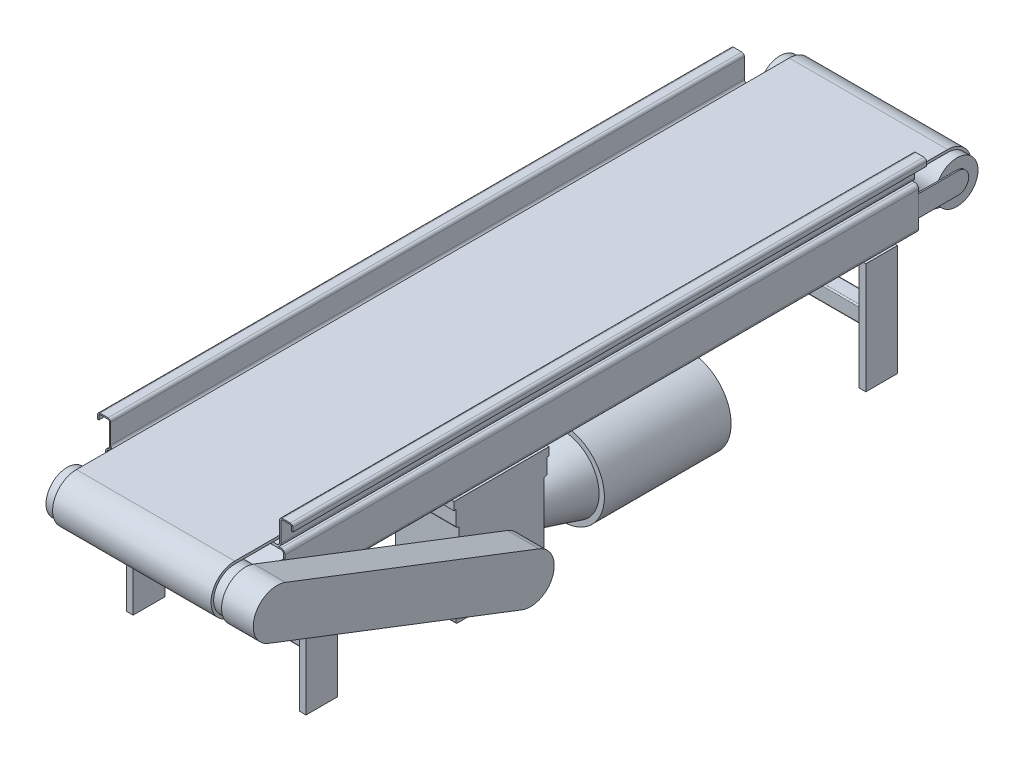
SolidWorks part; units mm, degrees
ref_plane "Front" through (0, 0, 0) normal (0, 0, 1) x (1, 0, 0)
ref_plane "Top" through (0, 0, 0) normal (0, 1, 0) x (1, 0, 0)
ref_plane "Right" through (0, 0, 0) normal (1, 0, 0) x (0, 0, -1)
sketch "Sketch1" plane through (0, 0, 0) normal (0, 0, 1) x (1, 0, 0)
  line L0 (0, 0) -> (0, 127) construction
  line L1 (196.85, 0) -> (-196.85, 0)
  line L2 (-203.2, 6.35) -> (-203.2, 53.975)
  line L3 (-209.55, 60.325) -> (-228.6, 60.325)
  line L4 (-234.95, 53.975) -> (-234.95, 44.45)
  line L5 (234.95, 53.975) -> (234.95, 44.45)
  line L6 (209.55, 60.325) -> (228.6, 60.325)
  line L7 (203.2, 6.35) -> (203.2, 53.975)
  line L8 (-231.775, 53.975) -> (-231.775, 44.45)
  line L9 (-209.55, 57.15) -> (-228.6, 57.15)
  line L10 (-206.375, 6.35) -> (-206.375, 53.975)
  line L11 (196.85, -3.175) -> (-196.85, -3.175)
  line L12 (206.375, 6.35) -> (206.375, 53.975)
  line L13 (209.55, 57.15) -> (228.6, 57.15)
  line L14 (231.775, 53.975) -> (231.775, 44.45)
  line L15 (-234.95, 44.45) -> (-231.775, 44.45)
  line L16 (234.95, 44.45) -> (231.775, 44.45)
  arc A0 (-196.85, 0) -> (-203.2, 6.35) centre (-196.85, 6.35) cw
  arc A1 (-203.2, 53.975) -> (-209.55, 60.325) centre (-209.55, 53.975) ccw
  arc A2 (-228.6, 60.325) -> (-234.95, 53.975) centre (-228.6, 53.975) ccw
  arc A3 (228.6, 60.325) -> (234.95, 53.975) centre (228.6, 53.975) cw
  arc A4 (203.2, 53.975) -> (209.55, 60.325) centre (209.55, 53.975) cw
  arc A5 (196.85, 0) -> (203.2, 6.35) centre (196.85, 6.35) ccw
  arc A6 (-228.6, 57.15) -> (-231.775, 53.975) centre (-228.6, 53.975) ccw
  arc A7 (-206.375, 53.975) -> (-209.55, 57.15) centre (-209.55, 53.975) ccw
  arc A8 (-196.85, -3.175) -> (-206.375, 6.35) centre (-196.85, 6.35) cw
  arc A9 (196.85, -3.175) -> (206.375, 6.35) centre (196.85, 6.35) ccw
  arc A10 (206.375, 53.975) -> (209.55, 57.15) centre (209.55, 53.975) cw
  arc A11 (228.6, 57.15) -> (231.775, 53.975) centre (228.6, 53.975) cw
  dimension "D4" = 6.35
  dimension "D1" = 406.4
  dimension "D2" = 60.325
  dimension "D3" = 31.75
  dimension "D5" = 44.45
  dimension "D6" = 3.175
extrude "Extrude1" add sketch "Sketch1" along normal mid plane 1524
sketch "Sketch2" plane through (0, 0, 0) normal (0, 0, 1) x (1, 0, 0)
  line L0 (-196.85, -3.175) -> (196.85, -3.175) construction
  line L1 (-206.375, -3.175) -> (-184.15, -3.175)
  line L2 (-215.9, -12.7) -> (-215.9, -95.25)
  line L3 (-206.375, -104.775) -> (-184.15, -104.775)
  line L4 (-184.15, -101.6) -> (-184.15, -104.775)
  line L5 (-212.725, -12.7) -> (-212.725, -95.25)
  line L6 (-206.375, -101.6) -> (-184.15, -101.6)
  line L7 (-184.15, -3.175) -> (-184.15, -6.35)
  line L8 (-206.375, -6.35) -> (-184.15, -6.35)
  line L9 (-203.2, 6.35) -> (-203.2, 53.975) construction
  line L10 (0, 0) -> (0, -104.775) construction
  line L11 (206.375, -6.35) -> (184.15, -6.35)
  line L12 (184.15, -3.175) -> (184.15, -6.35)
  line L13 (206.375, -101.6) -> (184.15, -101.6)
  line L14 (212.725, -12.7) -> (212.725, -95.25)
  line L15 (184.15, -101.6) -> (184.15, -104.775)
  line L16 (206.375, -104.775) -> (184.15, -104.775)
  line L17 (215.9, -12.7) -> (215.9, -95.25)
  line L18 (206.375, -3.175) -> (184.15, -3.175)
  arc A0 (212.725, -95.25) -> (206.375, -101.6) centre (206.375, -95.25) cw
  arc A1 (-206.375, -3.175) -> (-215.9, -12.7) centre (-206.375, -12.7) ccw
  arc A2 (-215.9, -95.25) -> (-206.375, -104.775) centre (-206.375, -95.25) ccw
  arc A3 (-206.375, -6.35) -> (-212.725, -12.7) centre (-206.375, -12.7) ccw
  arc A4 (-212.725, -95.25) -> (-206.375, -101.6) centre (-206.375, -95.25) ccw
  arc A5 (206.375, -6.35) -> (212.725, -12.7) centre (206.375, -12.7) cw
  arc A6 (215.9, -95.25) -> (206.375, -104.775) centre (206.375, -95.25) cw
  arc A7 (206.375, -3.175) -> (215.9, -12.7) centre (206.375, -12.7) cw
  dimension "D1" = 12.7
  dimension "D2" = 6.35
  dimension "D6" = 9.525
  dimension "D3" = 3.175
  dimension "D4" = 101.6
  dimension "D5" = 31.75
  dimension "D7" = 3.175
  dimension "D8" = 3.175
extrude "Extrude2" add sketch "Sketch2" along normal mid plane 1524
sketch "Sketch3" plane through (212.725, 0, 0) normal (-1, 0, 0) x (0, 0, 1)
  line L0 (762, -95.25) -> (762, -12.7) construction
  line L2 (0, 0) -> (0, 152.4) construction
  line L3 (762, -104.775) -> (-762, -104.775) construction
  circle A0 centre (857.25, -47.625) radius 50.8
  circle A1 centre (-857.25, -47.625) radius 50.8
  circle A2 centre (552.45, -53.975) radius 19.05
  circle A3 centre (-552.45, -53.975) radius 19.05
  dimension "D1" = 101.6
  dimension "D4" = 38.1
  dimension "D2" = 95.25
  dimension "D3" = 57.15
  dimension "D5" = 304.8
  dimension "D6" = 50.8
extrude "Extrude3" add sketch "Sketch3" along normal up to surface (425.45 mm away)
sketch "Sketch4" plane through (0, 0, 0) normal (1, 0, 0) x (0, 0, -1)
  line L0 (-845.58, -97.0664) -> (-558.285, -29.2543)
  line L1 (857.25, 3.175) -> (-857.25, 3.175)
  line L2 (844.1213, -103.2466) -> (556.8262, -35.4345)
  line L3 (0, 0) -> (0, 81.7063) construction
  line L4 (0, 0) -> (0, 81.7063) construction
  line L5 (845.58, -97.0664) -> (558.285, -29.2543)
  line L6 (-552.45, -28.575) -> (552.45, -28.575)
  line L7 (-552.45, -34.925) -> (552.45, -34.925)
  line L8 (-844.1213, -103.2466) -> (-556.8262, -35.4345)
  line L9 (857.25, 9.525) -> (-857.25, 9.525)
  circle A0 centre (-857.25, -47.625) radius 50.8 construction
  arc A1 (-857.25, 3.175) -> (-845.58, -97.0664) centre (-857.25, -47.625) ccw
  circle A3 centre (857.25, -47.625) radius 50.8 construction
  arc A4 (845.58, -97.0664) -> (857.25, 3.175) centre (857.25, -47.625) ccw
  circle A5 centre (-552.45, -53.975) radius 19.05 construction
  arc A6 (-552.45, -28.575) -> (-558.285, -29.2543) centre (-552.45, -53.975) ccw
  arc A7 (552.45, -28.575) -> (558.285, -29.2543) centre (552.45, -53.975) cw
  arc A8 (552.45, -34.925) -> (556.8262, -35.4345) centre (552.45, -53.975) cw
  arc A9 (-552.45, -34.925) -> (-556.8262, -35.4345) centre (-552.45, -53.975) ccw
  arc A10 (-857.25, 9.525) -> (-844.1213, -103.2466) centre (-857.25, -47.625) ccw
  arc A11 (844.1213, -103.2466) -> (857.25, 9.525) centre (857.25, -47.625) ccw
  circle A12 centre (-552.45, -53.975) radius 19.05 construction
  dimension "D1" = 6.35
extrude "Extrude4" add sketch "Sketch4" along normal mid plane 381 separate body
sketch "Sketch5" plane through (212.725, 0, 0) normal (1, 0, 0) x (0, 0, -1)
  line L0 (-857.25, -22.225) -> (-762, -22.225)
  line L1 (-762, -95.25) -> (-762, -12.7) construction
  line L2 (-857.25, -73.025) -> (-762, -73.025)
  line L3 (-762, -73.025) -> (-762, -22.225)
  line L4 (0, 0) -> (0, -177.0294) construction
  line L5 (762, -73.025) -> (762, -22.225)
  line L6 (857.25, -73.025) -> (762, -73.025)
  line L7 (857.25, -22.225) -> (762, -22.225)
  arc A0 (-857.25, -22.225) -> (-857.25, -73.025) centre (-857.25, -47.625) ccw
  arc A1 (857.25, -22.225) -> (857.25, -73.025) centre (857.25, -47.625) cw
  dimension "D1" = 50.8
extrude "Extrude5" add sketch "Sketch5" along normal blind 3.175
sketch "Sketch6" plane through (-212.725, 0, 0) normal (-1, 0, 0) x (0, 0, 1)
  line L0 (857.25, -73.025) -> (762, -73.025) construction
  line L1 (762, -22.225) -> (857.25, -22.225) construction
  line L2 (857.25, -73.025) -> (762, -73.025)
  line L3 (762, -22.225) -> (857.25, -22.225)
  line L4 (762, -22.225) -> (762, -73.025)
  line L5 (0, 0) -> (0, 205.8798) construction
  line L6 (-762, -22.225) -> (-762, -73.025)
  line L7 (-762, -22.225) -> (-857.25, -22.225)
  line L8 (-857.25, -73.025) -> (-762, -73.025)
  arc A0 (857.25, -73.025) -> (857.25, -22.225) centre (857.25, -47.625) ccw construction
  arc A1 (857.25, -73.025) -> (857.25, -22.225) centre (857.25, -47.625) ccw
  arc A2 (-857.25, -73.025) -> (-857.25, -22.225) centre (-857.25, -47.625) cw
extrude "Extrude6" add sketch "Sketch6" along normal blind 3.175
sketch "Sketch7" plane through (215.9, 0, 0) normal (1, 0, 0) x (0, 0, -1)
  line L0 (-762, -104.775) -> (762, -104.775) construction
  line L1 (-355.6, -104.775) -> (-127, -104.775)
  line L2 (-355.6, -104.775) -> (-355.6, -123.825)
  line L3 (-355.6, -123.825) -> (-127, -123.825)
  line L4 (-127, -123.825) -> (-127, -104.775)
  line L5 (-762, -95.25) -> (-762, -12.7) construction
  dimension "D1" = 406.4
  dimension "D2" = 19.05
  dimension "D3" = 228.6
extrude "Extrude7" add sketch "Sketch7" against normal blind 152.4
sketch "Sketch8" plane through (215.9, 0, 0) normal (1, 0, 0) x (0, 0, -1)
  line L0 (-350.8375, -123.825) -> (-131.7625, -123.825)
  line L1 (-355.6, -123.825) -> (-127, -123.825) construction
  line L2 (-131.7625, -123.825) -> (-131.7625, -158.75)
  line L3 (-134.9375, -161.925) -> (-135.7313, -161.925)
  line L4 (-131.7625, -342.9) -> (-131.7625, -358.775)
  line L5 (-134.9375, -361.95) -> (-347.6625, -361.95)
  line L6 (-241.3, -104.775) -> (-241.3, -375.5194) construction
  line L7 (-127, -104.775) -> (-355.6, -104.775) construction
  line L8 (-138.9063, -165.1) -> (-138.9062, -336.55)
  line L9 (-134.9375, -339.725) -> (-135.7313, -339.725)
  line L10 (-127, -123.825) -> (-127, -104.775) construction
  line L11 (-347.6625, -339.725) -> (-346.8687, -339.725)
  line L12 (-343.6937, -165.1) -> (-343.6937, -336.55)
  line L13 (-350.8375, -342.9) -> (-350.8375, -358.775)
  line L14 (-347.6625, -161.925) -> (-346.8687, -161.925)
  line L15 (-350.8375, -123.825) -> (-350.8375, -158.75)
  arc A0 (-131.7625, -158.75) -> (-134.9375, -161.925) centre (-134.9375, -158.75) cw
  arc A1 (-134.9375, -339.725) -> (-131.7625, -342.9) centre (-134.9375, -342.9) cw
  arc A2 (-131.7625, -358.775) -> (-134.9375, -361.95) centre (-134.9375, -358.775) cw
  arc A3 (-135.7313, -161.925) -> (-138.9063, -165.1) centre (-135.7313, -165.1) ccw
  arc A4 (-138.9062, -336.55) -> (-135.7313, -339.725) centre (-135.7312, -336.55) ccw
  arc A5 (-343.6937, -336.55) -> (-346.8687, -339.725) centre (-346.8687, -336.55) cw
  arc A6 (-346.8687, -161.925) -> (-343.6937, -165.1) centre (-346.8687, -165.1) cw
  arc A7 (-350.8375, -358.775) -> (-347.6625, -361.95) centre (-347.6625, -358.775) ccw
  arc A8 (-347.6625, -339.725) -> (-350.8375, -342.9) centre (-347.6625, -342.9) ccw
  arc A9 (-350.8375, -158.75) -> (-347.6625, -161.925) centre (-347.6625, -158.75) ccw
  point P42 (-241.3, -361.95)
  dimension "D1" = 3.175
  dimension "D2" = 238.125
  dimension "D3" = 4.7625
  dimension "D4" = 38.1
  dimension "D5" = 7.1437
  dimension "D6" = 177.8
extrude "Extrude8" add sketch "Sketch8" against normal blind 152.4
ref_plane "Plane2" through (139.7, 0, 0) normal (-1, 0, 0) x (0, 0, 1)
sketch "Sketch10" plane through (139.7, 0, 0) normal (-1, 0, 0) x (0, 0, 1)
  line L0 (138.9062, -250.825) -> (-393.9598, -250.825) construction
  line L1 (138.9062, -250.825) -> (138.9062, -194.0404)
  line L2 (138.9062, -194.0404) -> (19.05, -161.925)
  line L3 (19.05, -161.925) -> (19.05, -149.225)
  line L4 (19.05, -149.225) -> (-285.75, -149.225)
  line L5 (-285.75, -149.225) -> (-285.75, -250.825)
  line L6 (-285.75, -250.825) -> (138.9062, -250.825)
  line L7 (138.9062, -336.55) -> (138.9063, -165.1) construction
  line L8 (355.6, -104.775) -> (355.6, -123.825) construction
  dimension "D1" = 336.55
  dimension "D2" = 304.8
  dimension "D3" = 15
  dimension "D4" = 203.2
  dimension "D5" = 12.7
revolve "Revolve1" add sketch "Sketch10" angle 360 about L0
sketch "Sketch11" plane through (215.9, 0, 0) normal (1, 0, 0) x (0, 0, -1)
  line L0 (-227.0971, -229.2486) -> (-836.6971, 5.7014)
  line L1 (-877.8029, -100.9514) -> (-268.2029, -335.9014)
  line L2 (-127, -104.775) -> (-355.6, -104.775) construction
  arc A0 (-268.2029, -335.9014) -> (-227.0971, -229.2486) centre (-247.65, -282.575) ccw
  arc A1 (-836.6971, 5.7014) -> (-877.8029, -100.9514) centre (-857.25, -47.625) ccw
  dimension "D1" = 57.15
  dimension "D2" = 609.6
  dimension "D3" = 177.8
extrude "Extrude9" add sketch "Sketch11" along normal blind 76.2 separate body
shell "Shell1" thickness 3.175
sketch "Sketch12" plane through (0, -104.775, 0) normal (0, -1, 0) x (1, 0, 0)
  line L0 (-215.9, 762) -> (-215.9, -762) construction
  line L1 (-215.9, 711.2) -> (-215.9, 635)
  line L3 (0, 0) -> (0, 914.4) construction
  line L4 (-215.9, 711.2) -> (-200.025, 711.2)
  line L6 (-200.025, 711.2) -> (-200.025, 635)
  line L7 (-215.9, 635) -> (-200.025, 635)
  line L8 (-206.375, 762) -> (-184.15, 762) construction
  line L9 (215.9, 635) -> (200.025, 635)
  line L10 (200.025, 711.2) -> (200.025, 635)
  line L11 (215.9, 711.2) -> (200.025, 711.2)
  line L12 (215.9, 711.2) -> (215.9, 635)
  line L14 (0, 0) -> (-215.9, 0) construction
  line L15 (215.9, -711.2) -> (215.9, -635)
  line L16 (215.9, -711.2) -> (200.025, -711.2)
  line L17 (200.025, -711.2) -> (200.025, -635)
  line L18 (215.9, -635) -> (200.025, -635)
  line L19 (-215.9, -635) -> (-200.025, -635)
  line L20 (-200.025, -711.2) -> (-200.025, -635)
  line L21 (-215.9, -711.2) -> (-200.025, -711.2)
  line L22 (-215.9, -711.2) -> (-215.9, -635)
  dimension "D1" = 76.2
  dimension "D2" = 50.8
  dimension "D3" = 15.875
extrude "Extrude10" add sketch "Sketch12" along normal blind 266.7
sketch "Sketch13" plane through (-200.025, 0, 0) normal (1, 0, 0) x (0, 0, -1)
  line L0 (-711.2, -371.475) -> (-711.2, -104.775) construction
  line L1 (-688.975, -219.075) -> (-657.225, -219.075)
  line L2 (-692.15, -222.25) -> (-692.15, -254)
  line L3 (-688.975, -257.175) -> (-657.225, -257.175)
  line L4 (-654.05, -222.25) -> (-654.05, -254)
  line L5 (-635, -371.475) -> (-711.2, -371.475) construction
  line L6 (0, -24.7419) -> (0, 189.3355) construction
  line L7 (654.05, -222.25) -> (654.05, -254)
  line L8 (688.975, -257.175) -> (657.225, -257.175)
  line L9 (692.15, -222.25) -> (692.15, -254)
  line L10 (688.975, -219.075) -> (657.225, -219.075)
  arc A0 (-692.15, -222.25) -> (-688.975, -219.075) centre (-688.975, -222.25) cw
  arc A1 (-654.05, -222.25) -> (-657.225, -219.075) centre (-657.225, -222.25) ccw
  arc A2 (-657.225, -257.175) -> (-654.05, -254) centre (-657.225, -254) ccw
  arc A3 (-692.15, -254) -> (-688.975, -257.175) centre (-688.975, -254) ccw
  arc A4 (692.15, -254) -> (688.975, -257.175) centre (688.975, -254) cw
  arc A5 (657.225, -257.175) -> (654.05, -254) centre (657.225, -254) cw
  arc A6 (654.05, -222.25) -> (657.225, -219.075) centre (657.225, -222.25) cw
  arc A7 (692.15, -222.25) -> (688.975, -219.075) centre (688.975, -222.25) ccw
  dimension "D1" = 3.175
  dimension "D2" = 38.1
  dimension "D3" = 38.1
  dimension "D4" = 19.05
  dimension "D5" = 114.3
extrude "Extrude11" add sketch "Sketch13" along normal up to surface (400.05 mm away)
